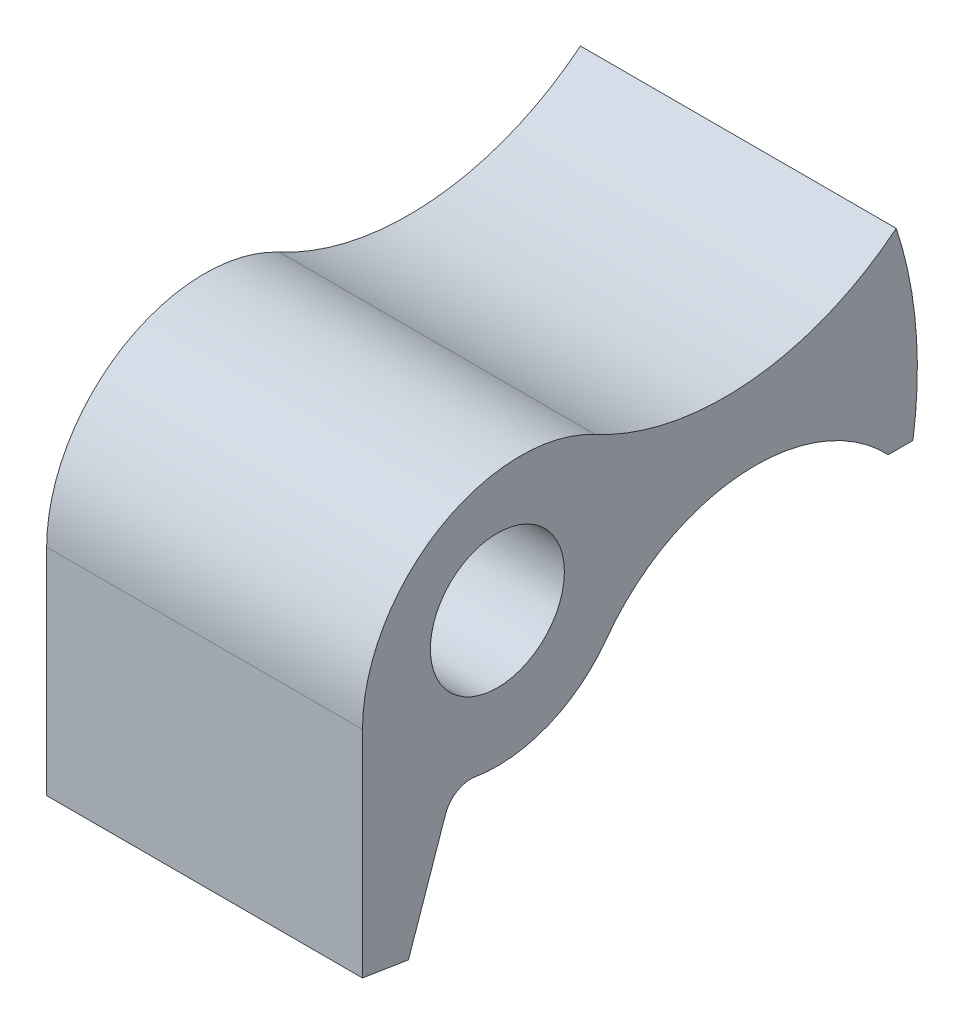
SolidWorks part; units mm, degrees
ref_plane "Спереди" through (0, 0, 0) normal (0, 0, 1) x (1, 0, 0)
ref_plane "Сверху" through (0, 0, 0) normal (0, 1, 0) x (1, 0, 0)
ref_plane "Справа" through (0, 0, 0) normal (1, 0, 0) x (0, 0, -1)
sketch "Эскиз1" plane through (0, 0, 0) normal (1, 0, 0) x (0, 0, -1)
  line L0 (-4.0132, -1.0595) -> (-4.0132, -7.4651)
  line L1 (-4.0132, -7.4651) -> (-2.6451, -7.6818)
  line L2 (-2.6451, -7.6818) -> (-1.5435, -4.4827)
  line L3 (0, 0) -> (0, -54.3623) construction
  line L4 (0, 0) -> (-52.8612, 0) construction
  line L5 (11.6305, -1.8034) -> (12.366, -1.8034)
  circle A0 centre (0, 0) radius 1.9939
  arc A1 (-4.0132, -1.0595) -> (2.9123, 3.0785) centre (0.6858, -1.0595) cw
  arc A2 (-0.6621, -3.9582) -> (3.2487, -2.3563) centre (0, 0) ccw
  arc A3 (12.366, -1.8034) -> (11.8688, 3.9116) centre (0, 0) ccw
  arc A4 (11.8688, 3.9116) -> (2.9123, 3.0785) centre (6.7636, 10.2362) cw
  arc A5 (11.6305, -1.8034) -> (3.2487, -2.3563) centre (7.6693, -5.5626) ccw
  arc A6 (-1.5435, -4.4827) -> (-0.6621, -3.9582) centre (-0.793, -4.7411) cw
  point P17 (6.7636, 2.1082)
  point P20 (7.6693, -0.1016)
  dimension "D1" = 3.9878
  dimension "D5" = 4.699
  dimension "D6" = 4.0132
  dimension "D7" = 12.4968
  dimension "D10" = 8.128
  dimension "D14" = 5.461
  dimension "D15" = 0.7937
  dimension "D2" = 19
  dimension "D3" = 9
  dimension "D4" = 8.001
  dimension "D8" = 5.715
  dimension "D9" = 4.0132
  dimension "D11" = 2.1082
  dimension "D12" = 3.9116
  dimension "D13" = 0.1016
extrude "Бобышка-Вытянуть1" add sketch "Эскиз1" along normal mid plane 9.398
sketch "Эскиз2" plane through (0, 0, 0) normal (1, 0, 0) x (0, 0, -1)
  line L0 (7.5014, -2.8101) -> (8.2318, 1.8019) construction
  line L1 (7.9705, 0.152) -> (9.99, -0.1679)
  line L2 (9.99, -0.1679) -> (9.8069, -1.324)
  line L3 (9.8069, -1.324) -> (7.7874, -1.0042)
  line L4 (7.7874, -1.0042) -> (7.9705, 0.152)
  line L5 (8.2318, 1.8019) -> (8.2318, -2.5192) construction
  dimension "D1" = 4.0894
  dimension "D2" = 7.8486
  dimension "D3" = 1.397
  dimension "D4" = 9
revolve "Вырез-Повернуть1" cut sketch "Эскиз2" angle 360 about L0
